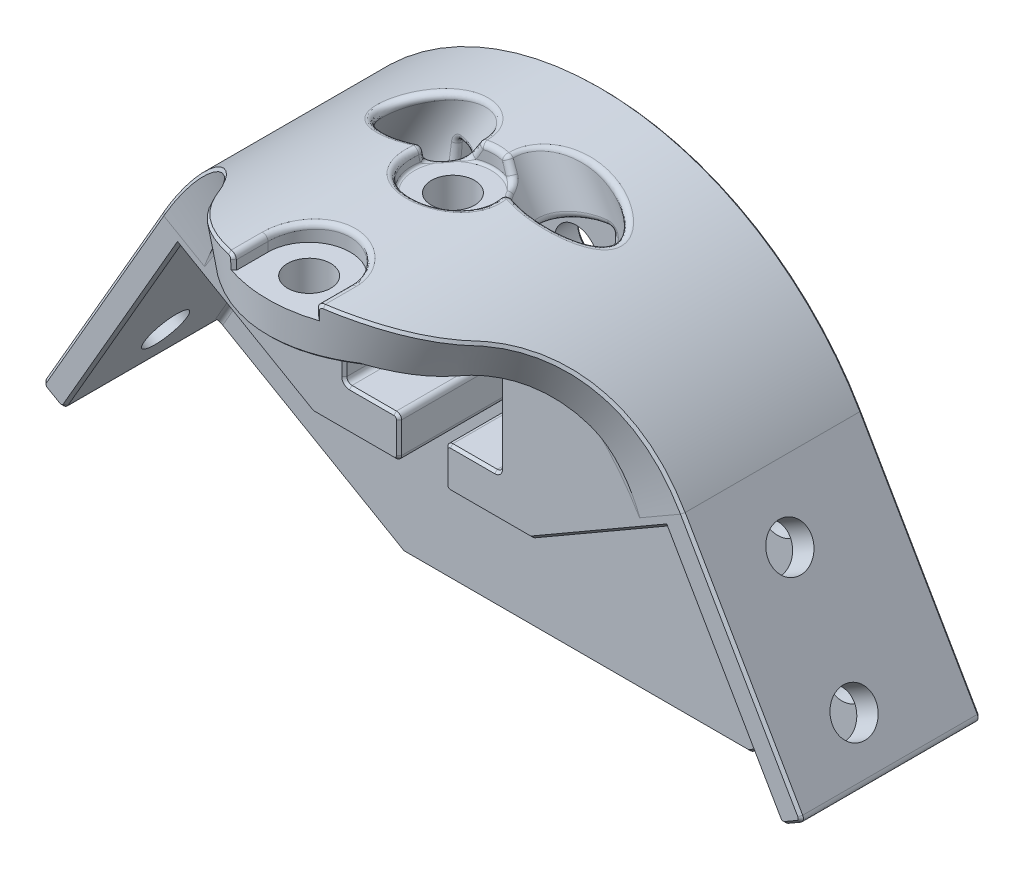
SolidWorks part; units mm, degrees
ref_plane "Płaszczyzna przednia" through (0, 0, 0) normal (0, 0, 1) x (1, 0, 0)
ref_plane "Płaszczyzna górna" through (0, 0, 0) normal (0, 1, 0) x (1, 0, 0)
ref_plane "Płaszczyzna prawa" through (0, 0, 0) normal (1, 0, 0) x (0, 0, -1)
sketch "Szkic2" plane through (0, 0, 0) normal (0, 0, 1) x (1, 0, 0)
  line L0 (0, 48.5816) -> (0, 18.2816) construction
  line L1 (-15.15, 48.5816) -> (15.15, 48.5816)
  line L2 (-15.15, 48.5816) -> (-15.15, 18.2816)
  line L3 (-15.15, 18.2816) -> (15.15, 18.2816)
  line L4 (15.15, 48.5816) -> (15.15, 18.2816)
  line L5 (0, 18.2816) -> (0, 10.2816) construction
  line L6 (0, 10.2816) -> (0, 0) construction
  line L8 (-74.1045, -11.1896) -> (-50.7331, 29.2908)
  line L9 (0, 48.5816) -> (0, 281.3446) construction
  line L10 (74.1045, -11.1896) -> (50.7331, 29.2908)
  line L12 (74.1045, -11.1896) -> (69.9476, -13.5896)
  line L13 (69.9476, -13.5896) -> (47.4476, 25.3816)
  line L14 (-74.1045, -11.1896) -> (-69.9476, -13.5896)
  line L16 (-69.9476, -13.5896) -> (-47.4476, 25.3816)
  line L17 (-47.4476, 25.3816) -> (-21.2936, 10.2816)
  line L20 (47.4476, 25.3816) -> (21.2936, 10.2816)
  line L27 (-21.2936, 10.2816) -> (21.2936, 10.2816)
  arc A0 (-50.7331, 29.2908) -> (50.7331, 29.2908) centre (0, 0) cw
  point P21 (0, 58.5816)
  dimension "D2" = 10
  dimension "D3" = 10
  dimension "D4" = 10
  dimension "D5" = 45
  dimension "D6" = 30.3
  dimension "D7" = 60
  dimension "D8" = 4.8
  dimension "D9" = 4.8
  dimension "D10" = 45
  dimension "D11" = 8
  dimension "D13" = 30.2
extrude "Dodanie-wyciągnięcie1" add sketch "Szkic2" along normal blind 30
sketch "Szkic3" plane through (0, 0, 30) normal (0, 0, 1) x (1, 0, 0)
  line L0 (15.15, 48.5816) -> (-15.15, 48.5816) construction
  line L1 (15.15, 48.5816) -> (-15.15, 48.5816)
  line L2 (-50.7331, 29.2908) -> (-44.0712, 25.4445)
  line L3 (44.0712, 25.4445) -> (50.7331, 29.2908)
  line L4 (-44.0712, 25.4445) -> (0, 0) construction
  line L5 (0, 0) -> (44.0712, 25.4445) construction
  arc A0 (50.7331, 29.2908) -> (-50.7331, 29.2908) centre (0, 0) ccw construction
  arc A1 (50.7331, 29.2908) -> (-50.7331, 29.2908) centre (0, 0) ccw
  arc A2 (-15.15, 48.5816) -> (-44.0712, 25.4445) centre (0, 0) ccw
  arc A3 (15.15, 48.5816) -> (44.0712, 25.4445) centre (0, 0) cw
extrude "Dodanie-wyciągnięcie2" add sketch "Szkic3" along normal blind 30
ref_plane "Płaszczyzna1" through (0, 58.5816, 0) normal (0, 1, 0) x (1, 0, 0)
sketch "Szkic4" plane through (0, 58.5816, 0) normal (0, 1, 0) x (1, 0, 0)
  line L0 (-50.7331, -30) -> (-74.1045, -30) construction
  line L1 (74.1045, -30) -> (50.7331, -30) construction
  line L3 (-50.7331, -60) -> (50.7331, -60) construction
  line L4 (-50.7331, -30) -> (-152.7515, -96.9535)
  line L5 (-152.7515, -96.9535) -> (111.6814, -96.9535)
  line L6 (111.6814, -96.9535) -> (50.7331, -30)
  arc A0 (-50.7331, -30) -> (-25.3666, -45) centre (-50.7331, -58.9488) cw
  arc A1 (50.7331, -30) -> (25.3666, -45) centre (50.7331, -58.9488) ccw
  arc A2 (-25.3666, -45) -> (25.3666, -45) centre (0, -31.0512) ccw
curve "Krzywa18"
ref_plane "Płaszczyzna2" through (0, 50.889, 0) normal (0, -1, 0) x (-1, 0, 0)
sketch "Szkic6" plane through (0, 50.889, 0) normal (0, -1, 0) x (-1, 0, 0)
  line L0 (-47.4476, -30) -> (-69.9476, -30) construction
  line L2 (69.9476, -30) -> (47.4476, -30) construction
  line L3 (-111.6814, -96.9535) -> (-44.0712, -30)
  line L4 (152.7515, -96.9535) -> (-111.6814, -96.9535)
  line L5 (44.0712, -30) -> (152.7515, -96.9535)
  line L9 (15.15, -60) -> (-15.15, -60) construction
  arc A3 (-22.0356, -45) -> (22.0356, -45) centre (0, -36.3144) ccw
  arc A4 (-22.0356, -45) -> (-44.0712, -30) centre (-44.0712, -53.6856) ccw
  arc A5 (44.0712, -30) -> (22.0356, -45) centre (44.0712, -53.6856) ccw
surface "Powierzchnia-Odsunięcie3" parameters "D1"=8
curve "Krzywa20"
surface "Powierzchnia-Wyciągnięcie po profilach2"
surface "Powierzchnia-Wydłuż2" parameters "D1"=2.1, "D2"=2.1
other "Przecięcie1"
sketch "Szkic36" plane through (0, 0, 30) normal (0, 0, 1) x (1, 0, 0)
  line L0 (-45.2565, 24.6508) -> (-44.5129, 25.6995)
  line L1 (-50.7331, 29.2908) -> (-44.0712, 25.4445) construction
  line L2 (-44.5129, 25.6995) -> (-41.1937, 23.9393)
  line L3 (-41.1937, 23.9393) -> (-42.2955, 22.7686)
  line L4 (-42.2955, 22.7686) -> (-45.2565, 24.6508)
  line L5 (44.2071, 25.2378) -> (41.6329, 23.9393)
  line L6 (41.6329, 23.9393) -> (42.293, 22.7214)
  line L7 (42.293, 22.7214) -> (44.9414, 24.2725)
  line L8 (44.9414, 24.2725) -> (44.2071, 25.2378)
extrude "Wytnij-wyciągnięcie9" cut sketch "Szkic36" against normal blind 1
sketch "Szkic37" plane through (0, 0, 29) normal (0, 0, 1) x (1, 0, 0)
  line L4 (44.9414, 24.2725) -> (44.2071, 25.2378)
  line L5 (44.2071, 25.2378) -> (41.6329, 23.9393)
  line L6 (41.6329, 23.9393) -> (42.293, 22.7214)
  line L7 (42.293, 22.7214) -> (44.9414, 24.2725)
  line L8 (44.9414, 24.2725) -> (44.2071, 25.2378)
  line L9 (44.2071, 25.2378) -> (41.6329, 23.9393)
  line L10 (41.6329, 23.9393) -> (42.293, 22.7214)
  line L11 (42.293, 22.7214) -> (44.9414, 24.2725)
  line L12 (-45.2565, 24.6508) -> (-42.2955, 22.7686)
  line L13 (-42.2955, 22.7686) -> (-41.1937, 23.9393)
  line L14 (-41.1937, 23.9393) -> (-44.5129, 25.6995)
  line L15 (-44.5129, 25.6995) -> (-45.2565, 24.6508)
  line L16 (-45.2565, 24.6508) -> (-42.2955, 22.7686)
  line L17 (-42.2955, 22.7686) -> (-41.1937, 23.9393)
  line L18 (-41.1937, 23.9393) -> (-44.5129, 25.6995)
  line L19 (-44.5129, 25.6995) -> (-45.2565, 24.6508)
  dimension "D1" = 0
  dimension "D2" = 0
extrude "Dodanie-wyciągnięcie5" add sketch "Szkic37" along normal blind 1
sketch "Szkic7" plane through (0, 0, 0) normal (0, 0, -1) x (-1, 0, 0)
  line L0 (-21.2936, 10.2816) -> (-43.7936, -28.6896)
  line L2 (-43.7936, -28.6896) -> (-69.9476, -13.5896)
  line L3 (-69.9476, -13.5896) -> (-74.1045, -11.1896) construction
  line L7 (69.9476, -13.5896) -> (43.7936, -28.6896)
  line L9 (69.9476, -13.5896) -> (74.1045, -11.1896)
  line L10 (74.1045, -11.1896) -> (50.7331, 29.2908)
  line L11 (-50.7331, 29.2908) -> (-74.1045, -11.1896)
  line L12 (-74.1045, -11.1896) -> (-69.9476, -13.5896)
  line L13 (-69.9476, -13.5896) -> (-47.4476, 25.3816)
  line L14 (-47.4476, 25.3816) -> (-21.2936, 10.2816)
  line L15 (-21.2936, 10.2816) -> (21.2936, 10.2816)
  line L16 (21.2936, 10.2816) -> (47.4476, 25.3816)
  line L17 (47.4476, 25.3816) -> (69.9476, -13.5896)
  line L18 (69.9476, -13.5896) -> (74.1045, -11.1896)
  line L19 (74.1045, -11.1896) -> (50.7331, 29.2908)
  line L20 (-50.7331, 29.2908) -> (-74.1045, -11.1896)
  line L21 (-74.1045, -11.1896) -> (-69.9476, -13.5896)
  line L24 (-21.2936, 10.2816) -> (21.2936, 10.2816)
  line L27 (43.7936, -28.6896) -> (21.2936, 10.2816)
  arc A1 (50.7331, 29.2908) -> (-50.7331, 29.2908) centre (0, 0) ccw
  arc A3 (50.7331, 29.2908) -> (-50.7331, 29.2908) centre (0, 0) ccw
  dimension "D2" = 35
  dimension "D3" = 35
  dimension "D1" = 0
extrude "Dodanie-wyciągnięcie3" add sketch "Szkic7" along normal blind 4
sketch "Szkic8" plane through (0, 0, 0) normal (0, 0, 1) x (1, 0, 0)
  line L0 (-56.784, -21.1896) -> (-34.284, 17.7816) construction
  line L1 (-43.7936, -28.6896) -> (-69.9476, -13.5896) construction
  line L2 (-47.4476, 25.3816) -> (-21.2936, 10.2816) construction
  line L3 (-21.2936, 10.2816) -> (-43.7936, -28.6896) construction
  line L4 (-15.15, 48.5816) -> (15.15, 18.2816) construction
  line L5 (56.784, -21.1896) -> (34.284, 17.7816) construction
  line L6 (69.9476, -13.5896) -> (43.7936, -28.6896) construction
  line L7 (21.2936, 10.2816) -> (47.4476, 25.3816) construction
  line L8 (43.7936, -28.6896) -> (21.2936, 10.2816) construction
  line L9 (21.2936, 10.2816) -> (47.4476, 25.3816) construction
  point P20 (-39.8236, 128.4719)
  point P21 (-39.284, 9.1213)
  point P22 (-51.784, -12.5293)
  point P23 (39.284, 9.1213)
  point P24 (51.784, -12.5293)
  point P27 (0, 33.4316)
  dimension "D1" = 15
  dimension "D2" = 15
  dimension "D3" = 10
  dimension "D4" = 10
  dimension "D5" = 10
  dimension "D6" = 10
hole_wizard "Otwór pod śrubę M81" positions "Szkic9" profile "Szkic10" hole size "M8" standard "DIN"
sketch "Szkic9" plane through (0, 0, 0) normal (0, 0, 1) x (1, 0, 0)
  point P0 (0, 33.4316)
  point P3 (-39.284, 9.1213)
  point P6 (-51.784, -12.5293)
  point P9 (39.284, 9.1213)
  point P12 (51.784, -12.5293)
sketch "Szkic10" plane through (0, 33.4316, 0) normal (1, 0, 0) x (0, -1, 0)
  line L0 (0, 0) -> (0, 4)
  line L1 (0, 4) -> (4.2, 4)
  line L2 (4.2, 4) -> (4.2, 0)
  line L5 (4.2, 0) -> (0, 0)
  line L11 (0, -6.35) -> (0, 107.95) construction
  dimension "Średnica otworu na wylot" = 8.4
  dimension "Głębokość otworu na wylot" = 4
sketch "Szkic11" plane through (-46.5762, 26.8908, 0) normal (0.866, -0.5, 0) x (0, 0, -1)
  line L0 (-15, -1.7427) -> (-15, -46.7427) construction
  line L1 (-30, -1.7427) -> (0, -1.7427) construction
  line L2 (-30, -46.7427) -> (0, -46.7427) construction
  line L3 (-30, -1.7427) -> (0, -1.7427) construction
  point P6 (-15, -11.7427)
  point P7 (-15, -36.7427)
  dimension "D1" = 10
  dimension "D2" = 10
hole_wizard "Otwór pod śrubę M82" positions "Szkic12" profile "Szkic13" hole size "M8" standard "DIN"
sketch "Szkic12" plane through (-46.5762, 26.8908, 0) normal (0.866, -0.5, 0) x (0, 0, -1)
  point P0 (-15, -11.7427)
  point P3 (-15, -36.7427)
sketch "Szkic13" plane through (-52.4476, 16.7213, 15) normal (0, 0, 1) x (0.5, 0.866, 0)
  line L0 (0, 0) -> (0, 39.6856)
  line L1 (0, 39.6856) -> (4.2, 39.6856)
  line L2 (4.2, 39.6856) -> (4.2, 0)
  line L5 (4.2, 0) -> (0, 0)
  line L11 (0, -6.35) -> (0, 107.95) construction
  dimension "Średnica otworu na wylot" = 8.4
  dimension "Głębokość otworu na wylot" = 39.6856
sketch "Szkic14" plane through (46.5762, 26.8908, 0) normal (-0.866, -0.5, 0) x (0, 0, 1)
  line L0 (15, -1.7427) -> (15, -46.7427) construction
  line L1 (30, -1.7427) -> (0, -1.7427) construction
  line L2 (30, -46.7427) -> (0, -46.7427) construction
  point P6 (15, -11.7427)
  point P7 (15, -36.7427)
  dimension "D1" = 10
  dimension "D2" = 10
hole_wizard "Otwór pod śrubę M83" positions "Szkic15" profile "Szkic16" hole size "M8" standard "DIN"
sketch "Szkic15" plane through (46.5762, 26.8908, 0) normal (-0.866, -0.5, 0) x (0, 0, 1)
  point P0 (15, -11.7427)
  point P3 (15, -36.7427)
sketch "Szkic16" plane through (52.4476, 16.7213, 15) normal (0, 0, 1) x (0.5, -0.866, 0)
  line L0 (0, 0) -> (0, 39.6856)
  line L1 (0, 39.6856) -> (4.2, 39.6856)
  line L2 (4.2, 39.6856) -> (4.2, 0)
  line L5 (4.2, 0) -> (0, 0)
  line L11 (0, -6.35) -> (0, 107.95) construction
  dimension "Średnica otworu na wylot" = 8.4
  dimension "Głębokość otworu na wylot" = 39.6856
sketch "Szkic17" plane through (0, 18.2816, 0) normal (0, 1, 0) x (1, 0, 0)
  line L0 (-15.15, 0) -> (15.15, -30)
  point P4 (0, -15)
hole_wizard "Otwór pod śrubę M84" positions "Szkic20" profile "Szkic21" hole size "M8" standard "DIN"
sketch "Szkic20" plane through (0, 18.2816, 0) normal (0, 1, 0) x (1, 0, 0)
  point P0 (0, -15)
sketch "Szkic21" plane through (0, 18.2816, 15) normal (1, 0, 0) x (0, 0, 1)
  line L0 (0, 0) -> (0, 46.9711)
  line L1 (0, 46.9711) -> (4.2, 46.9711)
  line L2 (4.2, 46.9711) -> (4.2, 0)
  line L5 (4.2, 0) -> (0, 0)
  line L11 (0, -6.35) -> (0, 107.95) construction
  dimension "Średnica otworu na wylot" = 8.4
  dimension "Głębokość otworu na wylot" = 46.9711
sketch "Szkic38" plane through (0, 48.5816, 0) normal (0, -1, 0) x (1, 0, 0)
  line L0 (0, 52) -> (0, 24)
  line L1 (-48.3329, 60) -> (51.7441, 60) construction
  spline S0 degree 3 poles (-1281.8202, 1578.8529) (185.3728, -818.5402) (-121.0759, -4.4194) (-10.5468, 57.4983) (-9.3105, 58.0736) (-7.3727, 58.7856) (-6.7193, 58.9954) (-5.4068, 59.3564) (-4.7462, 59.5082) (-2.7511, 59.8741) (-1.403, 59.9978) (0.6466, 60.0011) (1.3383, 59.9699) (2.7049, 59.8457) (3.3813, 59.7531) (5.391, 59.3886) (6.7047, 59.0298) (8.6369, 58.3215) (9.2754, 58.0566) (10.5199, 57.4815) (11.1287, 57.1705) (118.6979, -2.974) (-185.8037, -776.5369) (1303.6672, 1561.7558) knots -11.391048 -11.391048 -11.391048 -11.391048 0.125 0.125 0.25 0.25 0.3125 0.3125 0.375 0.375 0.5 0.5 0.5625 0.5625 0.625 0.625 0.75 0.75 0.8125 0.8125 0.875 0.875 12.094098 12.094098 12.094098 12.094098 only from (-15.15, 54.5778) to (15.15, 54.5776) construction
  spline S1 degree 3 poles (-15.15, 54.5778) (-14.0583, 55.415) (-12.9205, 56.1686) (-10.5468, 57.4983) (-9.3105, 58.0736) (-7.3727, 58.7856) (-6.7193, 58.9954) (-5.4068, 59.3564) (-4.7462, 59.5082) (-2.7511, 59.8741) (-1.403, 59.9978) (0.6466, 60.0011) (1.3383, 59.9699) (2.7049, 59.8457) (3.3813, 59.7531) (5.391, 59.3886) (6.7047, 59.0298) (8.6369, 58.3215) (9.2754, 58.0566) (10.5199, 57.4815) (11.1287, 57.1705) (12.9165, 56.1709) (14.0572, 55.4159) (15.15, 54.5776) knots 0 0 0 0 0.125 0.125 0.25 0.25 0.3125 0.3125 0.375 0.375 0.5 0.5 0.5625 0.5625 0.625 0.625 0.75 0.75 0.8125 0.8125 0.875 0.875 1 1 1 1
  dimension "D1" = 8
  dimension "D2" = 28
hole_wizard "Otwór pod śrubę M88" positions "Szkic39" profile "Szkic40" hole size "M8" standard "DIN"
sketch "Szkic39" plane through (0, 48.5816, 0) normal (0, -1, 0) x (-1, 0, 0)
  point P0 (0, -52)
  point P3 (0, -24)
sketch "Szkic40" plane through (0, 48.5816, 52) normal (1, 0, 0) x (0, 0, -1)
  line L0 (0, 0) -> (0, 10)
  line L1 (0, 10) -> (4.2, 10)
  line L2 (4.2, 10) -> (4.2, 0)
  line L5 (4.2, 0) -> (0, 0)
  line L11 (0, -6.35) -> (0, 107.95) construction
  dimension "Średnica otworu na wylot" = 8.4
  dimension "Głębokość otworu na wylot" = 10
ref_plane "Płaszczyzna3" through (0, 55.0816, 0) normal (0, -1, 0) x (-1, 0, 0)
sketch "Szkic41" plane through (0, 55.0816, 0) normal (0, -1, 0) x (-1, 0, 0)
  line L0 (0, -52) -> (0, -59.9999) construction
  line L1 (8, -52) -> (8, -59.9999)
  line L2 (-8, -52) -> (-8, -59.9999)
  circle A0 centre (0, -24) radius 8
  arc A1 (8, -52) -> (-8, -52) centre (0, -52) ccw
  arc A2 (-8, -59.9999) -> (8, -59.9999) centre (0, -59.9999) ccw
  spline S0 degree 3 number of poles 90 (50.7331, -30) -> (-50.7331, -30) construction
  point P9 (0, -56)
  dimension "D1" = 16
extrude "Wytnij-wyciągnięcie11" cut sketch "Szkic41" against normal through all
sketch "Szkic25" plane through (-0.8713, -1.5092, 0) normal (-0.5, -0.866, 0) x (0.866, -0.5, 0)
  line L0 (-53.5816, 30) -> (-53.5816, 0) construction
  line L1 (-53.7816, 30) -> (-23.5816, 30) construction
  line L2 (-53.7816, 0) -> (-23.5816, 0) construction
  line L4 (-23.5816, 30) -> (-23.5816, 0) construction
  line L5 (-53.5816, 30) -> (-23.5816, 0) construction
  point P8 (-38.5816, 15)
  dimension "D1" = 30
sketch "Szkic26" plane through (0.8713, -1.5092, 0) normal (0.5, -0.866, 0) x (0.866, 0.5, 0)
  line L0 (53.5816, 30) -> (53.5816, 0) construction
  line L1 (23.5816, 30) -> (53.7816, 30) construction
  line L2 (23.5816, 0) -> (53.7816, 0) construction
  line L3 (23.5816, 30) -> (23.5816, 0) construction
  line L4 (53.5816, 30) -> (23.5816, 0)
  point P8 (38.5816, 15)
  dimension "D1" = 30
hole_wizard "Otwór pod śrubę M86" positions "Szkic27" profile "Szkic28" hole size "M8" standard "DIN"
sketch "Szkic27" plane through (0.8713, -1.5092, 0) normal (0.5, -0.866, 0) x (-0.866, -0.5, 0)
  point P0 (-38.5816, -15)
sketch "Szkic28" plane through (34.284, 17.7816, 15) normal (0, 0, 1) x (0.866, 0.5, 0)
  line L0 (0, 0) -> (0, 89.5281)
  line L1 (0, 89.5281) -> (4.2, 89.5281)
  line L2 (4.2, 89.5281) -> (4.2, 0)
  line L5 (4.2, 0) -> (0, 0)
  line L11 (0, -6.35) -> (0, 107.95) construction
  dimension "Średnica otworu na wylot" = 8.4
  dimension "Głębokość otworu na wylot" = 89.5281
hole_wizard "Otwór pod śrubę M87" positions "Szkic29" profile "Szkic30" hole size "M8" standard "DIN"
sketch "Szkic29" plane through (-0.8713, -1.5092, 0) normal (-0.5, -0.866, 0) x (-0.866, 0.5, 0)
  point P0 (38.5816, -15)
sketch "Szkic30" plane through (-34.284, 17.7816, 15) normal (0, 0, 1) x (0.866, -0.5, 0)
  line L0 (0, 0) -> (0, 89.5281)
  line L1 (0, 89.5281) -> (4.2, 89.5281)
  line L2 (4.2, 89.5281) -> (4.2, 0)
  line L5 (4.2, 0) -> (0, 0)
  line L11 (0, -6.35) -> (0, 107.95) construction
  dimension "Średnica otworu na wylot" = 8.4
  dimension "Głębokość otworu na wylot" = 89.5281
ref_plane "Płaszczyzna4" through (3.1287, 5.419, 0) normal (-0.5, -0.866, 0) x (-0.866, 0.5, 0)
ref_plane "Płaszczyzna5" through (-3.1287, 5.419, 0) normal (0.5, -0.866, 0) x (-0.866, -0.5, 0)
sketch "Szkic31" plane through (3.1287, 5.419, 0) normal (-0.5, -0.866, 0) x (-0.866, 0.5, 0)
  circle A0 centre (38.5816, -15) radius 7
  dimension "D1" = 14
extrude "Wytnij-wyciągnięcie3" cut sketch "Szkic31" against normal through all
sketch "Szkic32" plane through (-3.1287, 5.419, 0) normal (0.5, -0.866, 0) x (-0.866, -0.5, 0)
  circle A0 centre (-38.5816, -15) radius 7
  dimension "D1" = 14
extrude "Wytnij-wyciągnięcie4" cut sketch "Szkic32" against normal through all
sketch "Szkic33" plane through (0, 0, 0) normal (0, 0, 1) x (1, 0, 0)
  line L0 (-15.15, 18.2816) -> (15.15, 18.2816) construction
  line L1 (-4.5, 18.2816) -> (4.5, 18.2816)
  line L2 (-4.5, 18.2816) -> (-4.5, 10.2816)
  line L3 (-4.5, 10.2816) -> (4.5, 10.2816)
  line L4 (4.5, 18.2816) -> (4.5, 10.2816)
  line L5 (-21.2936, 10.2816) -> (21.2936, 10.2816) construction
  line L6 (0, 18.2816) -> (0, 33.4316) construction
  dimension "D1" = 9
extrude "Wytnij-wyciągnięcie7" cut sketch "Szkic33" against normal through all both and the other way through all
sketch "Szkic43" plane through (0, 0, -4) normal (0, 0, -1) x (-1, 0, 0)
  line L11 (4.5, 18.2816) -> (4.5, 10.2816)
  line L12 (4.5, 10.2816) -> (21.2936, 10.2816)
  line L13 (21.2936, 10.2816) -> (43.7936, -28.6896)
  line L14 (43.7936, -28.6896) -> (74.1045, -11.1896)
  line L15 (74.1045, -11.1896) -> (50.7331, 29.2908)
  line L16 (-50.7331, 29.2908) -> (-74.1045, -11.1896)
  line L17 (-74.1045, -11.1896) -> (-43.7936, -28.6896)
  line L18 (-43.7936, -28.6896) -> (-21.2936, 10.2816)
  line L19 (-21.2936, 10.2816) -> (-4.5, 10.2816)
  line L20 (-4.5, 10.2816) -> (-4.5, 18.2816)
  line L21 (-4.5, 18.2816) -> (4.5, 18.2816)
  line L22 (4.5, 18.2816) -> (4.5, 10.2816)
  line L23 (4.5, 10.2816) -> (21.2936, 10.2816)
  line L24 (21.2936, 10.2816) -> (43.7936, -28.6896)
  line L25 (43.7936, -28.6896) -> (74.1045, -11.1896)
  line L26 (74.1045, -11.1896) -> (50.7331, 29.2908)
  line L27 (-50.7331, 29.2908) -> (-74.1045, -11.1896)
  line L28 (-74.1045, -11.1896) -> (-43.7936, -28.6896)
  line L29 (-43.7936, -28.6896) -> (-21.2936, 10.2816)
  line L30 (-21.2936, 10.2816) -> (-4.5, 10.2816)
  line L31 (-4.5, 10.2816) -> (-4.5, 18.2816)
  line L32 (-4.5, 18.2816) -> (4.5, 18.2816)
  circle A1 centre (-51.784, -12.5293) radius 4.2
  circle A2 centre (-51.784, -12.5293) radius 4.2
  circle A3 centre (-39.284, 9.1213) radius 4.2
  circle A4 centre (-39.284, 9.1213) radius 4.2
  circle A5 centre (51.784, -12.5293) radius 4.2
  circle A6 centre (51.784, -12.5293) radius 4.2
  circle A7 centre (39.284, 9.1213) radius 4.2
  circle A8 centre (39.284, 9.1213) radius 4.2
  circle A9 centre (0, 33.4316) radius 4.2
  circle A10 centre (0, 33.4316) radius 4.2
  arc A11 (50.7331, 29.2908) -> (-50.7331, 29.2908) centre (0, 0) ccw
  arc A12 (50.7331, 29.2908) -> (-50.7331, 29.2908) centre (0, 0) ccw
  dimension "D1" = 0
  dimension "D2" = 0
  dimension "D3" = 0
  dimension "D4" = 0
  dimension "D5" = 0
  dimension "D6" = 0
extrude "Dodanie-wyciągnięcie6" add sketch "Szkic43" along normal blind 1
sketch "Szkic44" plane through (0, 0, 0) normal (0, 0, 1) x (1, 0, 0)
  line L8 (4.25, 3.4337) -> (5.15, 3.4337)
  line L9 (4.25, -2.5663) -> (5.15, -2.5663)
  line L10 (4.25, -2.5684) -> (-5.15, -2.5684)
  line L11 (5.15, -2.5663) -> (5.15, 3.4337)
  line L12 (-5.15, 3.4316) -> (4.25, 3.4316)
  line L13 (-5.15, 3.4316) -> (-5.15, -2.5684)
  line L14 (33.6613, -34.5373) -> (4.25, -34.5373)
  line L15 (-33.6613, -34.5394) -> (4.25, -34.5394)
sketch "Szkic45" plane through (0, 0, -5) normal (0, 0, -1) x (-1, 0, 0)
  line L1 (33.6613, -34.5394) -> (-4.25, -34.5394) construction
  line L4 (-5.15, -2.5663) -> (-5.15, 3.4337) construction
  line L6 (5.15, 3.4316) -> (5.15, -2.5684) construction
  line L9 (33.6613, -34.5394) -> (-33.6613, -34.5394)
  line L12 (-5.15, -2.5663) -> (-5.15, 3.4337)
  line L13 (-5.15, -2.5663) -> (5.15, -2.5684)
  line L14 (5.15, 3.4316) -> (5.15, -2.5684)
  line L15 (5.15, 3.4316) -> (-5.15, 3.4337)
  line L16 (21.2936, 10.2816) -> (43.7936, -28.6896) construction
  line L21 (-21.2936, 10.2816) -> (-4.5, 10.2816) construction
  line L22 (21.2936, 10.2816) -> (43.7936, -28.6896)
  line L27 (-21.2936, 10.2816) -> (21.2936, 10.2816)
  line L28 (-43.7936, -28.6896) -> (-21.2936, 10.2816) construction
  line L29 (-43.7936, -28.6896) -> (-21.2936, 10.2816)
  line L30 (-43.7936, -28.6896) -> (-33.6613, -34.5394)
  line L31 (33.6613, -34.5394) -> (43.7936, -28.6896)
extrude "Dodanie-wyciągnięcie7" add sketch "Szkic45" against normal up to surface (5 mm away)
fillet "Zaokrąglenie1" radius 1 12 edges at (4.5, 18.2816, 15) (-4.5, 18.2816, 15) (4.5, 10.2816, 15) (-4.5, 10.2816, 15) (21.2936, 10.2816, 15) (-21.2936, 10.2816, 15) (-33.6613, -34.5394, -2.5) (33.6613, -34.5394, -2.5) (69.9476, -13.5896, 15) (-69.9476, -13.5896, 15) (-74.1045, -11.1896, 12.5) (74.1045, -11.1896, 12.5)
fillet "Zaokrąglenie2" radius 1 4 edges at (-15.15, 18.2816, 15) (15.15, 18.2816, 15) (15.15, 48.5816, 4.0493) (-15.15, 48.5816, 4.0493)
fillet "Zaokrąglenie3" radius 2 2 edges at (-31.7902, 39.7376, 30) (31.7902, 39.7376, 30)
fillet "Zaokrąglenie4" radius 0.4 8 edges at (4.5, 18.2816, -2.5) (-4.5, 18.2816, -2.5) (-4.5, 10.2816, -2.5) (4.5, 10.2816, -2.5) (5.15, -2.5663, -2.5) (-5.15, -2.5684, -2.5) (5.15, 3.4337, -2.5) (-5.15, 3.4316, -2.5)
fillet "Zaokrąglenie5" radius 1 11 edges at (-8.435, 48.5816, 15.4449) (-14.9406, 48.1939, 8.1728) (15.15, 36.9319, 15.2553) (14.7692, 48.3668, 8.1871) (4.538, 56.1602, 17.4116) (7.3295, 56.6121, 20.794) (-4.7761, 55.878, 17.5821) (-15.15, 36.9319, 15.2553) (8.435, 48.5816, 15.4449) (-4.0419, 58.442, 18.8286) (4.9396, 58.373, 19.7763)
fillet "Zaokrąglenie6" radius 1 8 edges at (7.0623, 55.6523, 20.2418) (7.5479, 57.7527, 21.3487) (-7.0588, 55.6434, 20.2352) (-7.5893, 57.8465, 21.4697) (-8, 58.0328, 55.4362) (8, 58.0328, 55.4362) (0.9129, 58.5745, 31.9477) (0.9129, 58.5745, 59.9477)
chamfer "Sfazowanie1" distance 0.5 angle 45 31 edges at (-5.0328, -2.4512, -5) (-5.15, 0.4317, -5) (-5.0329, 3.3145, -5) (-0.0001, 3.4326, -5) (5.0328, 3.3165, -5) (5.15, 0.4336, -5) (5.0329, -2.4492, -5) (0.0001, -2.5674, -5) (-4.2, 33.4316, -5) (-55.984, -12.5293, -5) (47.584, -12.5293, -5) (35.084, 9.1213, -5) (-43.484, 9.1213, -5) (-4.3828, 18.1644, -5) (0, 18.2816, -5) (4.3828, 18.1644, -5) (4.5, 14.2816, -5) (4.3828, 10.3987, -5) (0, 10.2816, -5) (-4.3828, 10.3987, -5) (-4.5, 14.2816, -5) (33.6522, -34.5053, -5) (53.5659, -23.0475, -5) (73.7044, -11.0824, -5) (62.1688, 9.4836, -5) (0, 58.5816, -5) (-62.1688, 9.4836, -5) (-73.7044, -11.0824, -5) (-53.5659, -23.0475, -5) (-33.6522, -34.5053, -5) (0, -34.5394, -5)
chamfer "Sfazowanie2" distance 0.5 angle 45 40 edges at (52.3535, -23.7475, 0) (-15.15, 48.5816, 27.4971) (15.15, 48.5816, 27.4971) (-34.4866, 17.8986, 30) (58.4476, 6.329, 30) (9.825, 18.2816, 30) (4.5, 14.2816, 30) (13.2628, 10.2816, 30) (34.4866, 17.8986, 30) (72.026, -12.3896, 30) (73.7044, -11.0824, 30) (70.0548, -13.1895, 30) (21.2845, 10.3157, 30) (4.7929, 10.5745, 30) (4.7929, 17.9887, 30) (-4.5, 14.2816, 30) (-13.2628, 10.2816, 30) (-72.026, -12.3896, 30) (-58.4476, 6.329, 30) (-73.7044, -11.0824, 30) (-70.0548, -13.1895, 30) (-21.2845, 10.3157, 30) (-4.7929, 10.5745, 30) (-4.7929, 17.9887, 30) (0, -34.5394, 0) (-52.3535, -23.7475, 0) (33.6522, -34.5053, 0) (-33.6522, -34.5053, 0) (-9.825, 18.2816, 30) (15.15, 32.882, 30) (-14.8571, 18.5745, 30) (14.8571, 18.5745, 30) (-15.15, 32.882, 30) (-30.7842, 37.9799, 30) (25.6005, 43.9808, 32) (-15.15, 48.1573, 30.7936) (15.15, 47.8457, 30.4784)
fillet "Zaokrąglenie7" radius 1 4 edges at (58.4476, 6.329, 0) (-58.4476, 6.329, 0) (-69.6065, -12.9306, 0) (69.6065, -12.9306, 0)
chamfer "Sfazowanie3" distance 0.5 angle 45 6 edges at (-8.4363, 57.6999, 58.7347) (-33.6092, 47.9815, 35.6119) (8.4779, 57.7268, 58.7229) (23.0664, 53.8493, 48.5432)
chamfer "Sfazowanie4" distance 0.5 angle 45 1 edges at (1.1917, 48.5816, 59.9679)
fillet "Zaokrąglenie8" radius 0.5 6 edges at (-4.4058, 55.0816, 16.5353) (4.4118, 55.0816, 16.5305) (8.1595, 55.0816, 21.4634) (-8.257, 55.0816, 21.3853) (0, 55.0816, 16) (0, 55.0816, 32)
fillet "Zaokrąglenie9" radius 1 9 edges at (-15.2868, 48.7091, 22.4914) (15.2868, 48.7091, 22.4914) (-2.515, 58.4662, 15.7461) (2.5165, 58.4656, 15.7448)
fillet "Zaokrąglenie10" radius 1 6 edges at (8.6813, 55.1398, 21.0659) (4.7303, 55.1395, 16.0857) (-4.731, 55.1388, 16.0878) (-8.6813, 55.1398, 21.0659) (6.0937, 55.0816, 18.9727) (-6.0937, 55.0816, 18.9727)
